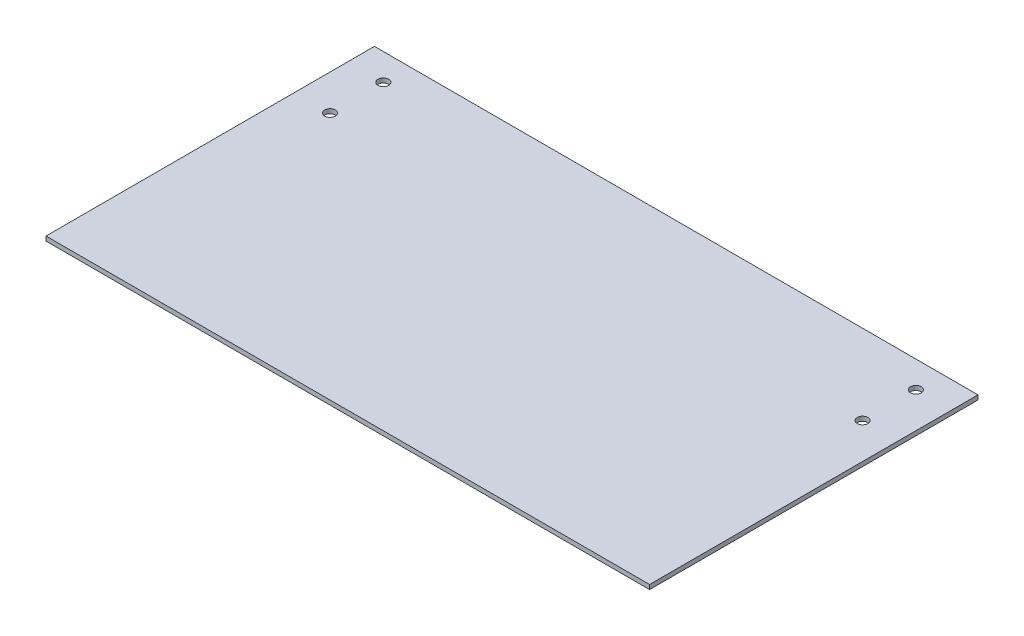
SolidWorks part; units mm, degrees
ref_plane "Front Plane" through (0, 0, 0) normal (0, 0, 1) x (1, 0, 0)
ref_plane "Top Plane" through (0, 0, 0) normal (0, 1, 0) x (1, 0, 0)
ref_plane "Right Plane" through (0, 0, 0) normal (1, 0, 0) x (0, 0, -1)
sketch "Sketch1" plane through (0, 0, 0) normal (0, 1, 0) x (1, 0, 0)
  line L1 (170, -92.5) -> (-170, -92.5)
  line L2 (170, -92.5) -> (170, 92.5)
  line L3 (170, 92.5) -> (-170, 92.5)
  line L4 (-170, -92.5) -> (-170, 92.5)
  line L5 (170, -92.5) -> (-170, 92.5) construction
  line L6 (170, 92.5) -> (-170, -92.5) construction
  point P0 (0, 0)
  dimension "D1" = 340
  dimension "D2" = 185
extrude "Boss-Extrude1" add sketch "Sketch1" along normal blind 2.5
sketch "Sketch2" plane through (0, 2.5, 0) normal (0, 1, 0) x (1, 0, 0)
  line L0 (-150, 47.5) -> (150, 47.5) construction
  line L1 (150, 47.5) -> (150, 77.5) construction
  line L2 (150, 77.5) -> (-150, 77.5) construction
  line L3 (-150, 77.5) -> (-150, 47.5) construction
  line L4 (170, 92.5) -> (-170, 92.5) construction
  circle A0 centre (-150, 77.5) radius 3
  circle A1 centre (-150, 47.5) radius 3
  circle A2 centre (150, 77.5) radius 3
  circle A3 centre (150, 47.5) radius 3
  point P8 (0, 47.5)
  dimension "D3" = 6
  dimension "D1" = 30
  dimension "D2" = 300
  dimension "D4" = 15
extrude "Cut-Extrude1" cut sketch "Sketch2" against normal through all
